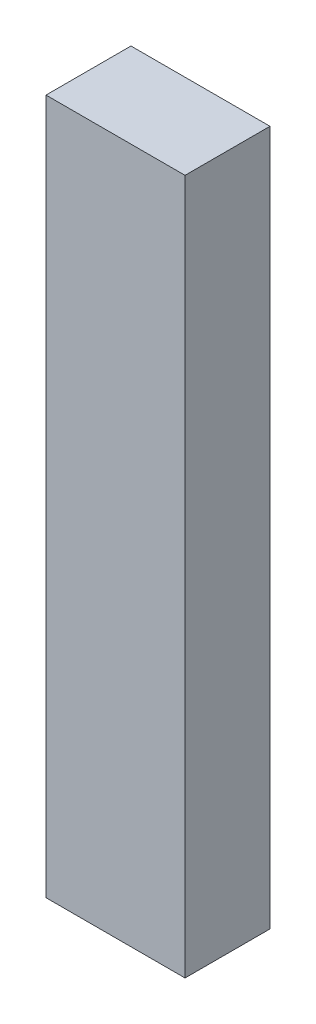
SolidWorks part; units mm, degrees
ref_plane "Front Plane" through (0, 0, 0) normal (0, 0, 1) x (1, 0, 0)
ref_plane "Top Plane" through (0, 0, 0) normal (0, 1, 0) x (1, 0, 0)
ref_plane "Right Plane" through (0, 0, 0) normal (1, 0, 0) x (0, 0, -1)
sketch "Sketch1" plane through (0, 0, 0) normal (0, 1, 0) x (1, 0, 0)
  line L1 (-9, 5.5) -> (9, 5.5)
  line L2 (-9, 5.5) -> (-9, -5.5)
  line L3 (-9, -5.5) -> (9, -5.5)
  line L4 (9, 5.5) -> (9, -5.5)
  line L5 (-9, 5.5) -> (9, -5.5) construction
  line L6 (-9, -5.5) -> (9, 5.5) construction
  point P0 (0, 0)
  dimension "D1" = 18
  dimension "D2" = 11
extrude "Boss-Extrude1" add sketch "Sketch1" along normal blind 90
